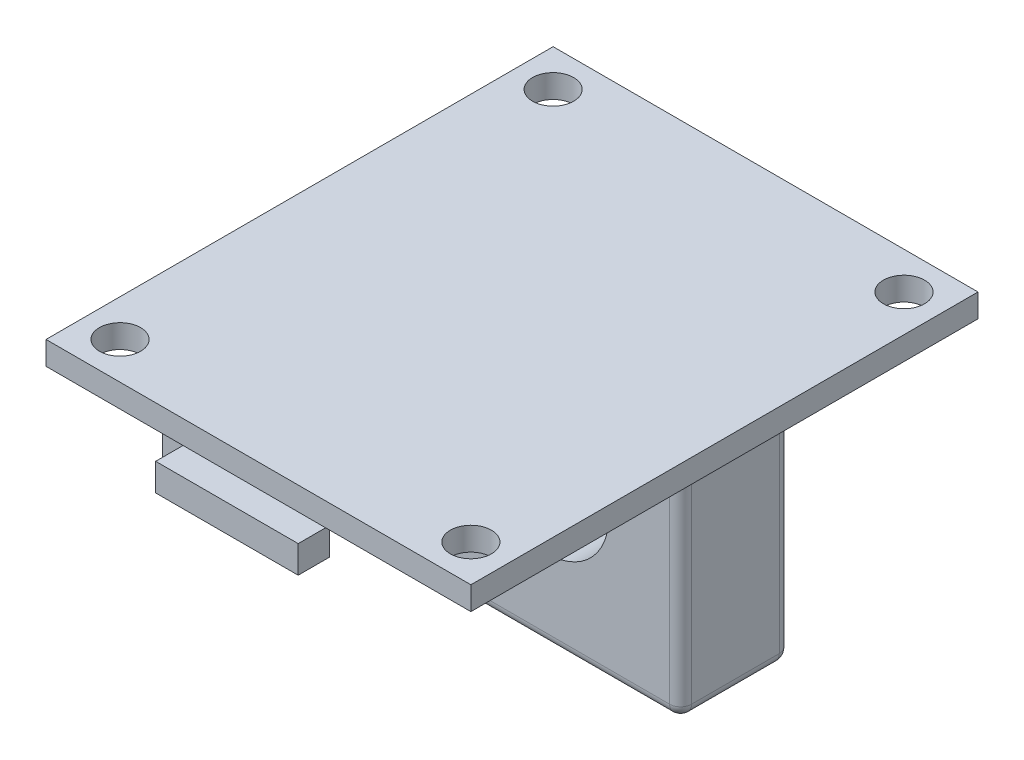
SolidWorks part; units mm, degrees
ref_plane "Front Plane" through (0, 0, 0) normal (0, 0, 1) x (1, 0, 0)
ref_plane "Top Plane" through (0, 0, 0) normal (0, 1, 0) x (1, 0, 0)
ref_plane "Right Plane" through (0, 0, 0) normal (1, 0, 0) x (0, 0, -1)
sketch "Sketch1" plane through (0, 0, 0) normal (0, 1, 0) x (1, 0, 0)
  line L1 (15.5, -18.5) -> (-15.5, -18.5)
  line L2 (15.5, -18.5) -> (15.5, 18.5)
  line L3 (15.5, 18.5) -> (-15.5, 18.5)
  line L4 (-15.5, -18.5) -> (-15.5, 18.5)
  line L5 (15.5, -18.5) -> (-15.5, 18.5) construction
  line L6 (15.5, 18.5) -> (-15.5, -18.5) construction
  point P0 (0, 0)
  dimension "D1" = 31
  dimension "D2" = 37
extrude "Boss-Extrude1" add sketch "Sketch1" along normal blind 1.7
sketch "Sketch2" plane through (0, 0, 0) normal (0, 1, 0) x (1, 0, 0)
  line L0 (-19.7215, 0) -> (30.5922, 0) construction
  circle A0 centre (-12.8, 15.8) radius 1.5
  circle A1 centre (12.8, 15.8) radius 1.5
  dimension "D1" = 2
  dimension "D2" = 15.8
  dimension "D3" = 15.8
extrude "Cut-Extrude1" cut sketch "Sketch2" against normal blind 1.7 and the other way through all
sketch "Sketch4" plane through (0, 0, 0) normal (0, 1, 0) x (1, 0, 0)
  line L0 (-15.5, 18.5) -> (-15.5, -18.5) construction
  line L1 (15.5, -18.5) -> (15.5, 18.5) construction
  line L2 (-15.5, -18.5) -> (15.5, -18.5) construction
  circle A0 centre (-12.8, -15.8) radius 1.5
  circle A1 centre (12.8, -15.8) radius 1.5
  dimension "D2" = 3
  dimension "D3" = 3
  dimension "D6" = 2.7
  dimension "D1" = 2.7
  dimension "D4" = 2.7
  dimension "D5" = 2.7
extrude "Cut-Extrude2" cut sketch "Sketch4" along normal blind 1.7
sketch "Sketch5" plane through (0, 0, 0) normal (0, 1, 0) x (1, 0, 0)
  line L0 (-15.5, 18.5) -> (-15.5, -18.5) construction
  line L1 (-14.7, -10.8) -> (-9.9, -10.8)
  line L2 (-14.7, -10.8) -> (-14.7, -1.3)
  line L3 (-14.7, -1.3) -> (-9.9, -1.3)
  line L4 (-9.9, -10.8) -> (-9.9, -1.3)
  line L5 (-15.5, -18.5) -> (15.5, -18.5) construction
  dimension "D1" = 9.5
  dimension "D2" = 4.8
  dimension "D3" = 0.8
  dimension "D4" = 7.7
extrude "Boss-Extrude2" add sketch "Sketch5" against normal blind 10
sketch "Sketch6" plane through (0, 0, 0) normal (0, -1, 0) x (-1, 0, 0)
  line L0 (15.5, 18.5) -> (15.5, -18.5) construction
  line L1 (9.3, 2.1) -> (-10.2, 2.1)
  line L2 (9.3, 2.1) -> (9.3, 10.1)
  line L3 (9.3, 10.1) -> (-10.2, 10.1)
  line L4 (-10.2, 2.1) -> (-10.2, 10.1)
  line L5 (-15.5, 18.5) -> (15.5, 18.5) construction
  dimension "D1" = 19.5
  dimension "D2" = 8
  dimension "D3" = 6.2
  dimension "D4" = 8.4
extrude "Boss-Extrude3" add sketch "Sketch6" along normal blind 20
fillet "Fillet1" radius 0.8 8 edges at (-9.3, -10, -10.1) (10.2, -10, -10.1) (10.2, -20, -6.1) (0.45, -20, -10.1) (-9.3, -20, -6.1) (0.45, -20, -2.1) (-9.3, -10, -2.1) (10.2, -10, -2.1)
sketch "Sketch7" plane through (0, 0, 0) normal (0, 0, 1) x (1, 0, 0)
  line L0 (0.45, -19.2) -> (0.45, -0.1065) construction
  line L1 (-8.5, -19.2) -> (9.4, -19.2) construction
  line L2 (-8.5, -9.6) -> (9.4, -9.6) construction
  line L3 (-8.5, 0) -> (-8.5, -19.2) construction
  line L4 (9.4, -19.2) -> (9.4, 0) construction
  circle A0 centre (0.45, -9.6533) radius 4.5
extrude "Cut-Extrude3" cut sketch "Sketch7" against normal blind 20
sketch "Sketch8" plane through (0, 0, 0) normal (0, -1, 0) x (-1, 0, 0)
  line L0 (15.5, 18.5) -> (15.5, -18.5) construction
  line L1 (5.5, -20.5) -> (-4.9, -20.5)
  line L2 (5.5, -20.5) -> (5.5, -18.2)
  line L3 (5.5, -18.2) -> (-4.9, -18.2)
  line L4 (-4.9, -20.5) -> (-4.9, -18.2)
  line L5 (15.5, -18.5) -> (-15.5, -18.5) construction
  dimension "D1" = 10.4
  dimension "D2" = 2.3
  dimension "D3" = 10
  dimension "D4" = 2
extrude "Boss-Extrude4" add sketch "Sketch8" along normal blind 2
